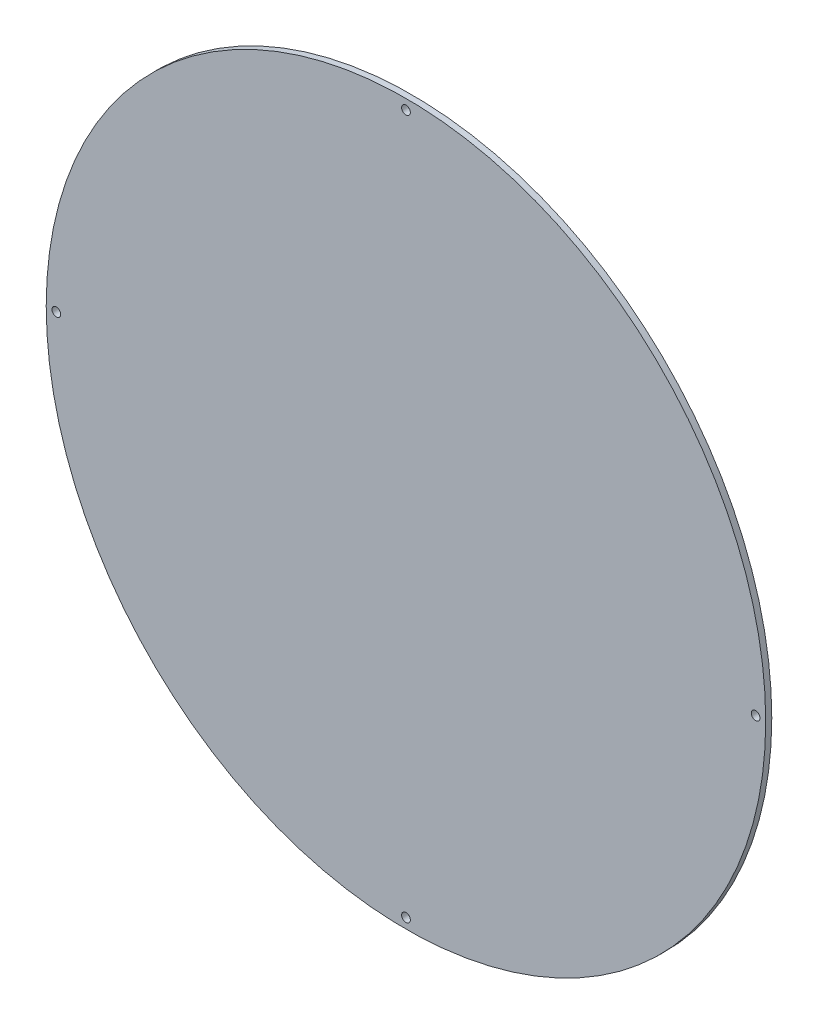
SolidWorks part; units mm, degrees
ref_plane "Front Plane" through (0, 0, 0) normal (0, 0, 1) x (1, 0, 0)
ref_plane "Top Plane" through (0, 0, 0) normal (0, 1, 0) x (1, 0, 0)
ref_plane "Right Plane" through (0, 0, 0) normal (1, 0, 0) x (0, 0, -1)
sketch "Sketch1" plane through (0, 0, 0) normal (0, 0, 1) x (1, 0, 0)
  line L0 (0, 171.1208) -> (0, -171.1208) construction
  line L1 (-174.4216, 0) -> (182.7605, 0) construction
  circle A0 centre (0, 0) radius 177.8
  circle A1 centre (0, 0) radius 172.8 construction
  dimension "D1" = 355.6
  dimension "D2" = 345.6
extrude "Boss-Extrude1" add sketch "Sketch1" along normal blind 3
sketch "Sketch2" plane through (0, 0, 0) normal (0, 0, -1) x (-1, 0, 0)
  line L0 (0, 171.1208) -> (0, -171.1208) construction
  circle A0 centre (0, 172.8) radius 1.8288
  circle A1 centre (0, 0) radius 172.8 construction
  dimension "D1" = 3.6576
extrude "Cut-Extrude1" [suppressed] cut sketch "Sketch2" against normal blind 2.54
pattern_circular "CirPattern1" [suppressed] count 6 over 360
sketch "Sketch3" plane through (0, 0, 3) normal (0, 0, 1) x (1, 0, 0)
  line L0 (-175.0466, 0) -> (197.5056, 0) construction
  line L1 (0, 169.1017) -> (0, -172.4988) construction
  line L2 (180.0747, 0) -> (-180.0747, 0) construction
  circle A0 centre (0, 0) radius 172.8 construction
  circle A1 centre (0, 0) radius 150 construction
  circle A2 centre (172.8, 0) radius 2
  point P7 (172.8, 0)
  dimension "D2" = 300
  dimension "D3" = 4
  dimension "D1" = 90
hole_wizard "M4 Clearance Hole1" positions "3DSketch9" profile "Sketch14" hole size "M4" standard "Ansi Metric"
sketch3d "3DSketch9"
  point P0 (172.8, 0, 3)
sketch "Sketch14" plane through (172.8, 0, 3) normal (1, 0, 0) x (0, -1, 0)
  line L0 (0, 0) -> (0, 26.6919)
  line L1 (0, 26.6919) -> (2.15, 25.4)
  line L2 (2.15, 25.4) -> (2.15, 0)
  line L5 (2.15, 0) -> (0, 0)
  line L10 (0, 26.6919) -> (-2.15, 25.4) construction
  line L11 (0, -6.35) -> (0, 107.95) construction
  dimension "Hole Dia." = 4.3
  dimension "Hole Depth" = 25.4
  dimension "Drill Angle" = 118
pattern_circular "CirPattern2" count 4 over 360 about axis through (0, 0, 0) along (0, 0, 1) of "M4 Clearance Hole1"
sketch "Sketch15" plane through (0, 0, 3) normal (0, 0, 1) x (1, 0, 0)
  circle A0 centre (0, 0) radius 59.6
  dimension "D1" = 119.2
extrude "Cut-Extrude2" [suppressed] cut sketch "Sketch15" against normal blind 10
sketch "Sketch16" plane through (0, 0, 0) normal (0, 0, -1) x (-1, 0, 0)
  line L0 (-145.8465, -145.8465) -> (145.8465, 145.8465) construction
  line L1 (-149.4095, 149.4095) -> (135.4638, -135.4638) construction
  line L2 (0, 194.2027) -> (0, -200.607) construction
  line L3 (174.4216, 0) -> (-182.7605, 0) construction
  line L4 (102.7078, 145.1342) -> (91.9239, 134.3503)
  line L5 (91.9239, 134.3503) -> (134.3503, 91.9239)
  line L6 (134.3503, 91.9239) -> (145.1342, 102.7078)
  circle A0 centre (0, 0) radius 177.8 construction
  arc A1 (145.1342, 102.7078) -> (102.7078, 145.1342) centre (0, 0) ccw
  dimension "D1" = 45
  dimension "D2" = 45
  dimension "D3" = 60
  dimension "D4" = 160
extrude "Cut-Extrude3" [suppressed] cut sketch "Sketch16" against normal blind 1
pattern_circular "CirPattern3" [suppressed] count 4 over 360
